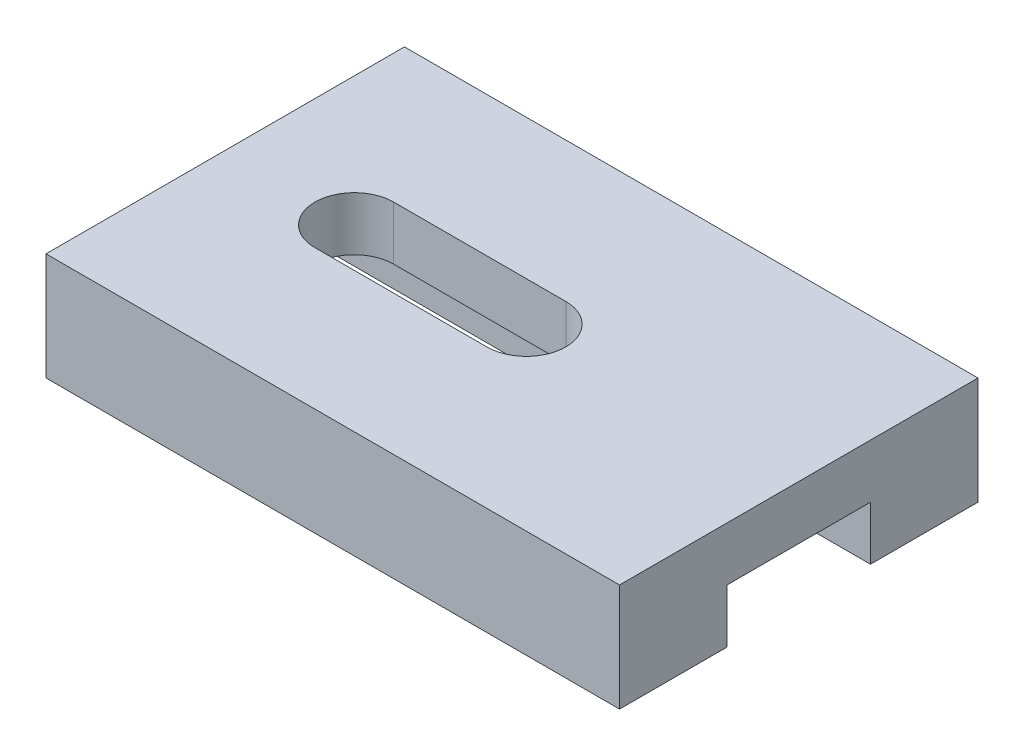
SolidWorks part; units mm, degrees
ref_plane "前视基准面" through (0, 0, 0) normal (0, 0, 1) x (1, 0, 0)
ref_plane "上视基准面" through (0, 0, 0) normal (0, 1, 0) x (1, 0, 0)
ref_plane "右视基准面" through (0, 0, 0) normal (1, 0, 0) x (0, 0, -1)
sketch "Sketch1" plane through (0, 0, 0) normal (0, 1, 0) x (1, 0, 0)
  line L0 (-72.6601, 0) -> (85.506, 0) construction
  line L1 (0, 57.4055) -> (0, -55.3983) construction
  line L3 (-60, 50) -> (100, 50)
  line L4 (-60, 50) -> (-60, -50)
  line L5 (-60, -50) -> (100, -50)
  line L6 (100, 50) -> (100, -50)
  dimension "D1" = 100
  dimension "D3" = 160
  dimension "D4" = 60
extrude "Extrude1" add sketch "Sketch1" along normal blind 30
sketch "草图1" plane through (-60, 0, 0) normal (-1, 0, 0) x (0, 0, 1)
  line L0 (-20, 0) -> (-20, 15)
  line L1 (-50, 0) -> (50, 0) construction
  line L2 (-20, 15) -> (20, 15)
  line L3 (20, 15) -> (20, 0)
  line L4 (20, 0) -> (-20, 0)
  line L5 (0, 0) -> (0, 50.1656) construction
  dimension "D1" = 40
  dimension "D2" = 15
extrude "切除-拉伸1" cut sketch "草图1" against normal through all
sketch "草图2" plane through (0, 30, 0) normal (0, 1, 0) x (1, 0, 0)
  line L0 (24, 26) -> (-24, 26) construction
  line L1 (24, -26) -> (-24, -26) construction
  line L2 (-20.3576, 0) -> (66.2324, 0) construction
  line L3 (0, 33.7165) -> (0, -34.7382) construction
  line L8 (24, 11) -> (-24, 11)
  line L9 (24, -11) -> (-24, -11)
  arc A0 (24, -26) -> (24, 26) centre (24, 0) ccw construction
  arc A1 (-24, -26) -> (-24, 26) centre (-24, 0) cw construction
  arc A2 (24, -11) -> (24, 11) centre (24, 0) ccw
  arc A3 (-24, -11) -> (-24, 11) centre (-24, 0) cw
  dimension "D3" = 15
  dimension "D1" = 26
  dimension "D2" = 48
extrude "切除-拉伸2" cut sketch "草图2" against normal through all
